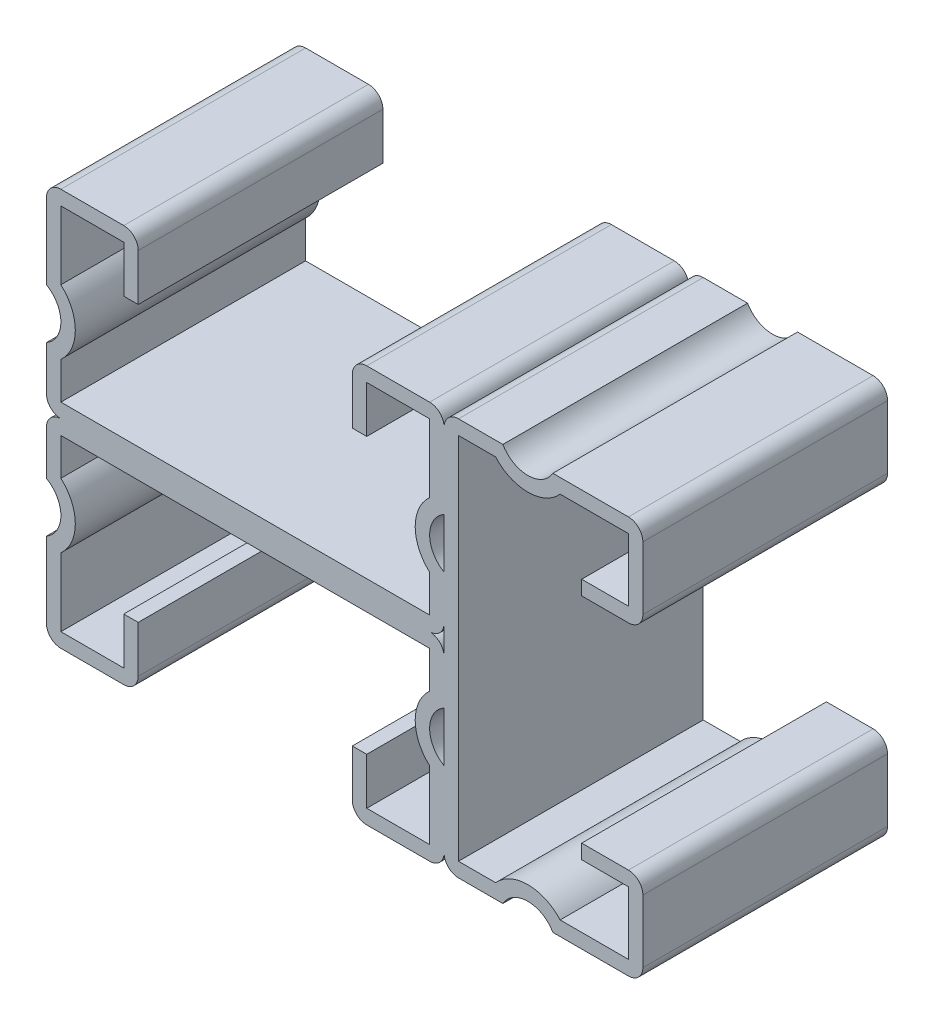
SolidWorks part; units mm, degrees
ref_plane "Plane1" through (0, 0, 0) normal (0, 0, 1) x (1, 0, 0)
ref_plane "Plane2" through (0, 0, 0) normal (0, 1, 0) x (1, 0, 0)
ref_plane "Plane3" through (0, 0, 0) normal (1, 0, 0) x (0, 0, -1)
sketch "Sketch1" plane through (0, 0, 0) normal (0, 0, 1) x (1, 0, 0)
  line L0 (-20.6375, 19.1389) -> (-20.6375, 11.2952)
  line L1 (-20.6375, 6.1038) -> (-20.6375, 1.4986)
  line L2 (-19.1389, 0) -> (19.1389, 0)
  line L3 (20.6375, 1.4986) -> (20.6375, 6.1038)
  line L4 (20.6375, 11.2952) -> (20.6375, 19.1389)
  line L5 (19.1389, 20.6375) -> (12.6111, 20.6375)
  line L6 (11.1125, 19.1389) -> (11.1125, 14.2875)
  line L7 (-19.1389, 20.6375) -> (-12.6111, 20.6375)
  line L8 (-11.1125, 19.1389) -> (-11.1125, 14.2875)
  line L9 (19.1389, 3.4236) -> (19.1389, 6.4516) construction
  line L10 (-19.1389, 15.1511) -> (-19.1389, 3.4236) construction
  line L11 (-12.6111, 19.1389) -> (-12.6111, 14.2875)
  line L12 (-19.1389, 19.1389) -> (-12.6111, 19.1389)
  line L13 (-19.1389, 19.1389) -> (-19.1389, 12.0505)
  line L14 (-19.1389, 5.3485) -> (-19.1389, 1.4986)
  line L15 (-19.1389, 1.4986) -> (19.1389, 1.4986)
  line L16 (19.1389, 1.4986) -> (19.1389, 5.3485)
  line L17 (19.1389, 12.0505) -> (19.1389, 19.1389)
  line L18 (19.1389, 19.1389) -> (12.6111, 19.1389)
  line L19 (12.6111, 19.1389) -> (12.6111, 14.2875)
  line L20 (-12.6111, 14.2875) -> (-11.1125, 14.2875)
  line L21 (11.1125, 14.2875) -> (12.6111, 14.2875)
  arc A0 (20.6375, 11.2952) -> (20.6375, 6.1038) centre (22.1361, 8.6995) ccw
  arc A1 (-20.6375, 6.1038) -> (-20.6375, 11.2952) centre (-22.1361, 8.6995) ccw
  arc A2 (-12.6111, 20.6375) -> (-11.1125, 19.1389) centre (-12.6111, 19.1389) cw
  arc A3 (-20.6375, 19.1389) -> (-19.1389, 20.6375) centre (-19.1389, 19.1389) cw
  arc A4 (-19.1389, 0) -> (-20.6375, 1.4986) centre (-19.1389, 1.4986) cw
  arc A5 (20.6375, 1.4986) -> (19.1389, 0) centre (19.1389, 1.4986) cw
  arc A6 (19.1389, 20.6375) -> (20.6375, 19.1389) centre (19.1389, 19.1389) cw
  arc A7 (11.1125, 19.1389) -> (12.6111, 20.6375) centre (12.6111, 19.1389) cw
  arc A8 (-19.1389, 5.3485) -> (-19.1389, 12.0505) centre (-22.1361, 8.6995) ccw
  arc A9 (19.1389, 12.0505) -> (19.1389, 5.3485) centre (22.1361, 8.6995) ccw
  dimension "D1" = 20.6375
  dimension "D9" = 2.9972
  dimension "D10" = 2.9972
  dimension "D2" = 8.6995
  dimension "Width" = 41.275
  dimension "D6" = 22.225
  dimension "edge" = 9.525
  dimension "Lip" = 6.35
  dimension "gauge" = 1.4986
extrude "Base-Extrude" add sketch "Sketch1" along normal mid plane 25.4
mirror "Mirror1" about plane through (0, 0, 0) normal (0, 1, 0) of "Base-Extrude"
sketch "Sketch2" plane through (20.1612, 0.1588, 0) normal (0, 0, 1) x (0, -1, 0)
  line L0 (-20.4788, 19.6152) -> (-20.4788, 11.7714)
  line L1 (-20.4788, 6.5801) -> (-20.4788, 1.9749)
  line L2 (-18.9802, 0.4763) -> (19.2976, 0.4763)
  line L3 (20.7962, 1.9749) -> (20.7962, 6.5801)
  line L4 (20.7962, 11.7714) -> (20.7962, 19.6152)
  line L5 (19.2977, 21.1138) -> (12.7698, 21.1138)
  line L6 (11.2712, 19.6152) -> (11.2712, 14.7638)
  line L7 (-18.9802, 21.1138) -> (-12.4523, 21.1138)
  line L8 (-10.9538, 19.6152) -> (-10.9538, 14.7638)
  line L9 (19.2976, 3.8998) -> (19.2976, 6.9279) construction
  line L10 (-18.9802, 15.6274) -> (-18.9802, 3.8998) construction
  line L11 (-12.4523, 19.6152) -> (-12.4524, 14.7638)
  line L12 (-18.9802, 19.6152) -> (-12.4523, 19.6152)
  line L13 (-18.9802, 19.6152) -> (-18.9802, 12.5267)
  line L14 (-18.9802, 5.8248) -> (-18.9802, 1.9749)
  line L15 (-18.9802, 1.9749) -> (19.2976, 1.9749)
  line L16 (19.2976, 1.9749) -> (19.2976, 5.8248)
  line L17 (19.2977, 12.5267) -> (19.2977, 19.6152)
  line L18 (19.2977, 19.6152) -> (12.7698, 19.6152)
  line L19 (12.7698, 19.6152) -> (12.7698, 14.7638)
  line L20 (-12.4524, 14.7638) -> (-10.9538, 14.7638)
  line L21 (11.2712, 14.7638) -> (12.7698, 14.7638)
  arc A0 (20.7962, 11.7714) -> (20.7962, 6.5801) centre (22.2948, 9.1758) ccw
  arc A1 (-20.4788, 6.5801) -> (-20.4788, 11.7714) centre (-21.9774, 9.1758) ccw
  arc A2 (-12.4523, 21.1138) -> (-10.9538, 19.6152) centre (-12.4523, 19.6152) cw
  arc A3 (-20.4788, 19.6152) -> (-18.9802, 21.1138) centre (-18.9802, 19.6152) cw
  arc A4 (-18.9802, 0.4763) -> (-20.4788, 1.9749) centre (-18.9802, 1.9749) cw
  arc A5 (20.7962, 1.9749) -> (19.2976, 0.4763) centre (19.2976, 1.9749) cw
  arc A6 (19.2977, 21.1138) -> (20.7962, 19.6152) centre (19.2977, 19.6152) cw
  arc A7 (11.2712, 19.6152) -> (12.7698, 21.1138) centre (12.7698, 19.6152) cw
  arc A8 (-18.9802, 5.8248) -> (-18.9802, 12.5267) centre (-21.9774, 9.1758) ccw
  arc A9 (19.2977, 12.5267) -> (19.2976, 5.8248) centre (22.2948, 9.1758) ccw
  dimension "D1" = 20.6375
  dimension "D9" = 2.9972
  dimension "D10" = 2.9972
  dimension "D2" = 8.6995
  dimension "D3" = 20.6375
  dimension "Width" = 41.275
  dimension "D6" = 22.225
  dimension "edge" = 9.525
  dimension "Lip" = 6.35
  dimension "D4" = 20.6375
  dimension "gauge" = 1.4986
extrude "Boss-Extrude1" add sketch "Sketch2" along normal mid plane 25.4
equation "\"D1@Sketch1\" = \"Width@Sketch1\" / 2"
equation "\"D6@Sketch1\" = \"Width@Sketch1\" - 2 * \"edge@Sketch1\""
equation "\"D10@Sketch1\" = 2 * \"gauge@Sketch1\""
equation "\"D9@Sketch1\" = \"D10@Sketch1\""
equation "\"D1@Boss-Extrude1\" = \"D1@Base-Extrude\""
